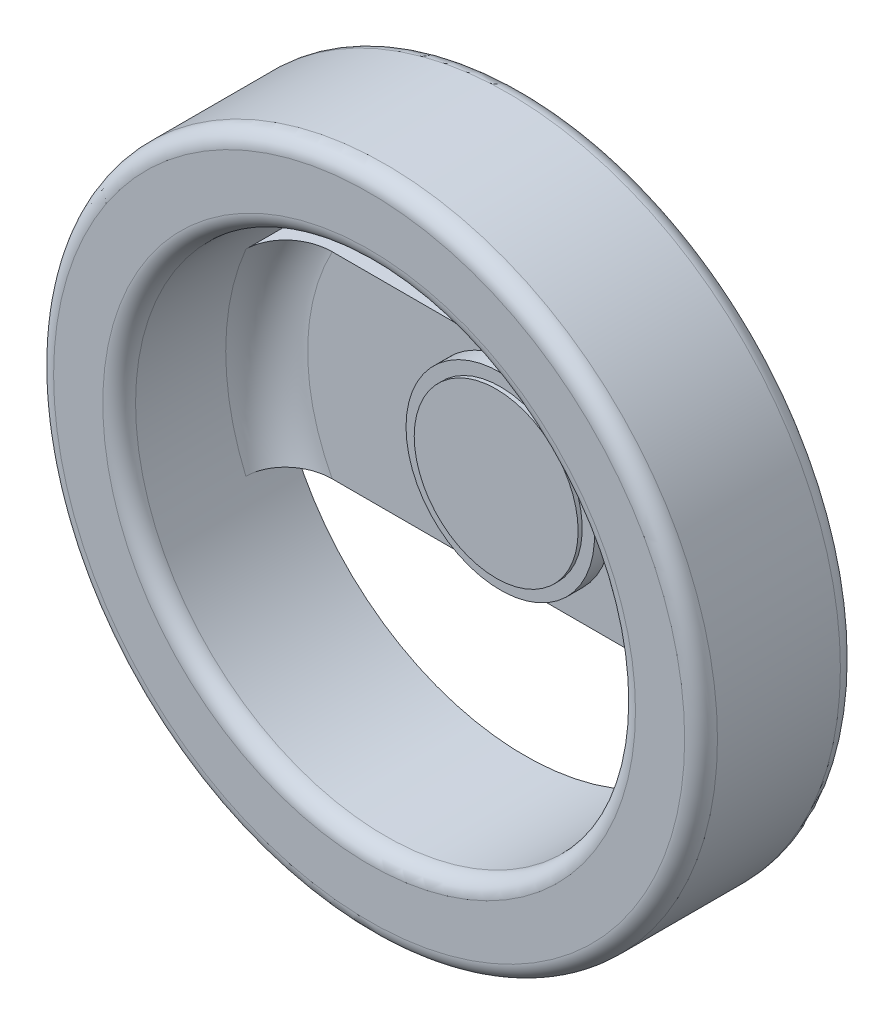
SolidWorks part; units mm, degrees
ref_plane "Face" through (0, 0, 0) normal (0, 0, 1) x (1, 0, 0)
ref_plane "Dessus" through (0, 0, 0) normal (0, 1, 0) x (1, 0, 0)
ref_plane "Gauche" through (0, 0, 0) normal (1, 0, 0) x (0, 0, -1)
sketch "Esquisse1" plane through (0, 0, 0) normal (0, 0, 1) x (1, 0, 0)
  circle A0 centre (0, 0) radius 40.5
  circle A1 centre (0, 0) radius 30.5
  dimension "D1" = 81
  dimension "D2" = 61
extrude "Base-Extrusion" add sketch "Esquisse1" along normal blind 19
sketch "Esquisse4" plane through (0, 0, 0) normal (0, 0, -1) x (-1, 0, 0)
  line L0 (38.6814, -12) -> (-38.6814, -12)
  line L2 (-38.6814, 12) -> (38.6814, 12)
  circle A0 centre (0, 0) radius 40.5 construction
  arc A1 (38.6814, -12) -> (38.6814, 12) centre (0, 0) ccw
  arc A2 (-38.6814, 12) -> (-38.6814, -12) centre (0, 0) ccw
  dimension "D1" = 12
  dimension "D2" = 12
extrude "Boss.-Extru.1" add sketch "Esquisse4" against normal blind 1
sketch "Esquisse5" plane through (0, 0, 0) normal (0, 0, -1) x (-1, 0, 0)
  circle A0 centre (0, 0) radius 11.5
  dimension "D1" = 23
extrude "Boss.-Extru.2" add sketch "Esquisse5" along normal blind 16 and the other way blind 3
sketch "Esquisse6" plane through (0, -12, 0) normal (0, -1, 0) x (1, 0, 0)
  line L0 (-28.0401, 0) -> (-2.3061, -12)
  line L1 (-2.3061, -12) -> (2.3061, -12)
  line L2 (0, 35.1742) -> (0, -46.7091) construction
  line L3 (-28.0401, 0) -> (28.0401, 0)
  line L4 (28.0401, 0) -> (2.3061, -12)
  point P9 (0, 0)
  point P10 (0, -12)
  dimension "D1" = 12
  dimension "D2" = 25
extrude "Boss.-Extru.3" add sketch "Esquisse6" against normal up to vertex (24 mm away)
fillet "Congé2" radius 5 2 edges at (-30.5, 0, 1) (30.5, 0, 1)
fillet "Congé3" radius 2 2 edges at (40.5, 0, 19) (30.5, 0, 19)
fillet "Congé6" radius 2 1 edges at (40.5, 0, 0)
sketch "Esquisse7" plane through (0, 0, -16) normal (0, 0, -1) x (-1, 0, 0)
  circle A0 centre (0, 0) radius 4
  dimension "D1" = 8
extrude "Enlèv. mat.-Extru.1" cut sketch "Esquisse7" against normal blind 17
sketch "Esquisse8" plane through (0, 0, 3) normal (0, 0, 1) x (1, 0, 0)
  circle A0 centre (0, 0) radius 10
  dimension "D1" = 20
extrude "Boss.-Extru.4" add sketch "Esquisse8" along normal blind 0.5
